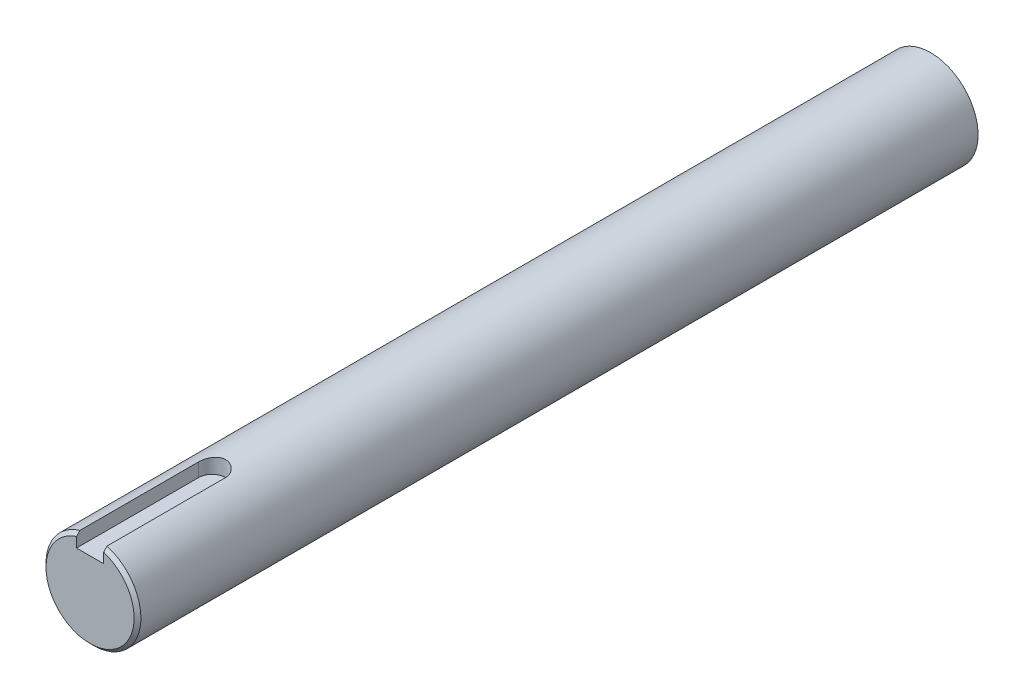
SolidWorks part; units mm, degrees
ref_plane "前视基准面" through (0, 0, 0) normal (0, 0, 1) x (1, 0, 0)
ref_plane "上视基准面" through (0, 0, 0) normal (0, 1, 0) x (1, 0, 0)
ref_plane "右视基准面" through (0, 0, 0) normal (1, 0, 0) x (0, 0, -1)
sketch "草图1" plane through (0, 0, 0) normal (0, 0, 1) x (1, 0, 0)
  line L0 (2, 4.7) -> (-2, 4.7)
  line L1 (0, 11.0283) -> (0, -13.3285) construction
  line L3 (2, 4.7) -> (2, 6.7082)
  line L4 (-2, 4.7) -> (-2, 6.7082)
  arc A0 (-2, 6.7082) -> (2, 6.7082) centre (0, 0) ccw
  dimension "D1" = 14
  dimension "D2" = 4.7
extrude "凸台-拉伸1" add sketch "草图1" along normal blind 98
sketch "草图2" plane through (0, 0, 0) normal (0, 0, -1) x (-1, 0, 0)
  circle A0 centre (0, 0) radius 7
  dimension "D1" = 14
extrude "凸台-拉伸4" add sketch "草图2" against normal blind 80
sketch "草图6" plane through (0, 4.7, 0) normal (0, 1, 0) x (1, 0, 0)
  line L0 (-2, -80) -> (-2, -98) construction
  line L1 (-2, -80) -> (2, -80)
  arc A0 (2, -80) -> (-2, -80) centre (0, -80) ccw
extrude "切除-拉伸20" cut sketch "草图6" along normal blind 80
chamfer "倒角1" distance 0.5 angle 45 1 edges at (0, -7, 98)
sketch "草图7" plane through (0, 0, 0) normal (0, 0, -1) x (-1, 0, 0)
  circle A0 centre (0, 0) radius 7
extrude "凸台-拉伸5" add sketch "草图7" along normal blind 26
